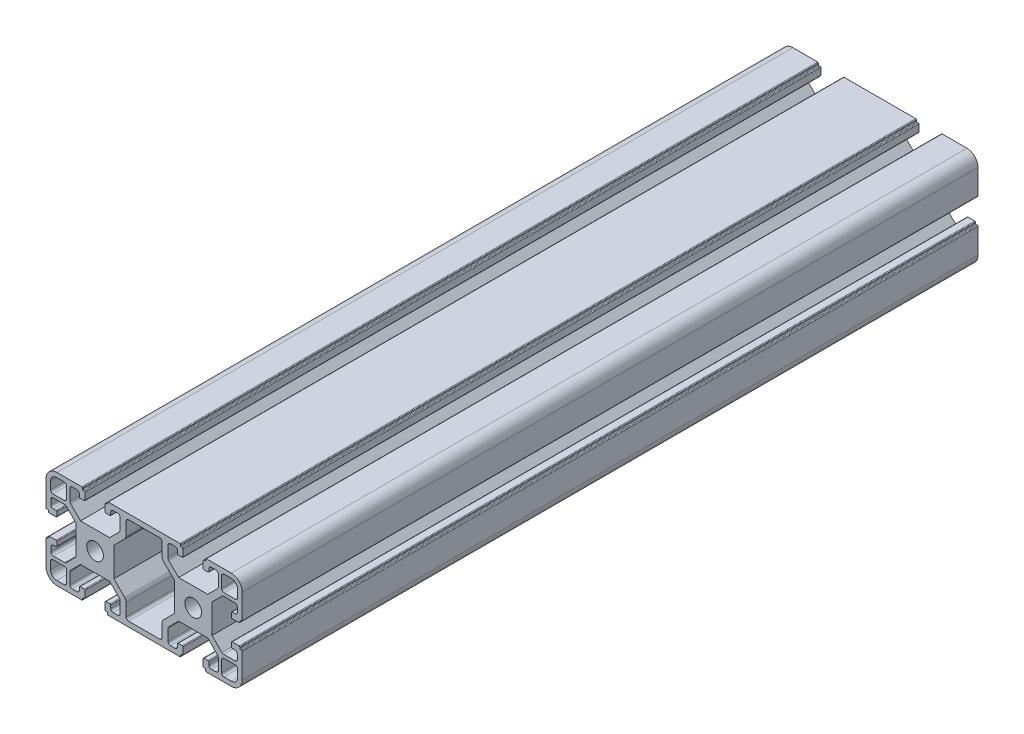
SolidWorks part; units mm, degrees
ref_plane "前视基准面" through (0, 0, 0) normal (0, 0, 1) x (1, 0, 0)
ref_plane "上视基准面" through (0, 0, 0) normal (0, 1, 0) x (1, 0, 0)
ref_plane "右视基准面" through (0, 0, 0) normal (1, 0, 0) x (0, 0, -1)
sketch "Model" plane through (0, 0, 0) normal (0, 0, 1) x (1, 0, 0)
  line L0 (2332.8218, 1245.2954) -> (2328.7969, 1241.2705)
  line L1 (2328.7969, 1241.2705) -> (2328.7969, 1229.406)
  line L2 (2328.7969, 1229.406) -> (2332.8218, 1225.3812)
  line L3 (2333.5289, 1225.0883) -> (2338.0969, 1225.0883)
  line L4 (2339.0969, 1226.0883) -> (2339.0969, 1227.9383)
  line L5 (2338.0969, 1228.9383) -> (2336.9969, 1228.9383)
  line L6 (2336.6969, 1229.2383) -> (2336.6969, 1230.9383)
  line L7 (2336.9969, 1231.2383) -> (2339.7969, 1231.2383)
  line L8 (2340.0969, 1230.9383) -> (2340.0969, 1230.5383)
  line L9 (2340.3969, 1230.2383) -> (2340.7969, 1230.2383)
  line L10 (2341.0969, 1229.9383) -> (2341.0969, 1219.8383)
  line L11 (2336.5969, 1215.3383) -> (2326.4969, 1215.3383)
  line L12 (2326.1969, 1215.6383) -> (2326.1969, 1216.0383)
  line L13 (2325.8969, 1216.3383) -> (2325.4969, 1216.3383)
  line L14 (2325.1969, 1216.6383) -> (2325.1969, 1219.4383)
  line L15 (2325.4969, 1219.7383) -> (2327.1969, 1219.7383)
  line L16 (2327.4969, 1219.4383) -> (2327.4969, 1218.3383)
  line L17 (2328.4969, 1217.3383) -> (2330.3469, 1217.3383)
  line L18 (2331.3469, 1218.3383) -> (2331.3469, 1222.9063)
  line L19 (2331.054, 1223.6134) -> (2327.0292, 1227.6383)
  line L20 (2327.0292, 1227.6383) -> (2315.1647, 1227.6383)
  line L21 (2315.1647, 1227.6383) -> (2311.1398, 1223.6134)
  line L22 (2310.8469, 1222.9063) -> (2310.8469, 1218.3383)
  line L23 (2311.8469, 1217.3383) -> (2313.6969, 1217.3383)
  line L24 (2314.6969, 1218.3383) -> (2314.6969, 1219.4383)
  line L25 (2314.9969, 1219.7383) -> (2316.6969, 1219.7383)
  line L26 (2316.9969, 1219.4383) -> (2316.9969, 1216.6383)
  line L27 (2316.6969, 1216.3383) -> (2316.2969, 1216.3383)
  line L28 (2315.9969, 1216.0383) -> (2315.9969, 1215.6383)
  line L29 (2315.6969, 1215.3383) -> (2286.4969, 1215.3383)
  line L30 (2286.1969, 1215.6383) -> (2286.1969, 1216.0383)
  line L31 (2285.8969, 1216.3383) -> (2285.4969, 1216.3383)
  line L32 (2285.1969, 1216.6383) -> (2285.1969, 1219.4383)
  line L33 (2285.4969, 1219.7383) -> (2287.1969, 1219.7383)
  line L34 (2287.4969, 1219.4383) -> (2287.4969, 1218.3383)
  line L35 (2288.4969, 1217.3383) -> (2290.3469, 1217.3383)
  line L36 (2291.3469, 1218.3383) -> (2291.3469, 1222.9063)
  line L37 (2291.054, 1223.6134) -> (2287.0292, 1227.6383)
  line L38 (2287.0292, 1227.6383) -> (2275.1647, 1227.6383)
  line L39 (2275.1647, 1227.6383) -> (2271.1398, 1223.6134)
  line L40 (2270.8469, 1222.9063) -> (2270.8469, 1218.3383)
  line L41 (2271.8469, 1217.3383) -> (2273.6969, 1217.3383)
  line L42 (2274.6969, 1218.3383) -> (2274.6969, 1219.4383)
  line L43 (2274.9969, 1219.7383) -> (2276.6969, 1219.7383)
  line L44 (2276.9969, 1219.4383) -> (2276.9969, 1216.6383)
  line L45 (2276.6969, 1216.3383) -> (2276.2969, 1216.3383)
  line L46 (2275.9969, 1216.0383) -> (2275.9969, 1215.6383)
  line L47 (2275.6969, 1215.3383) -> (2265.5969, 1215.3383)
  line L48 (2261.0969, 1219.8383) -> (2261.0969, 1229.9383)
  line L49 (2261.3969, 1230.2383) -> (2261.7969, 1230.2383)
  line L50 (2262.0969, 1230.5383) -> (2262.0969, 1230.9383)
  line L51 (2262.3969, 1231.2383) -> (2265.1969, 1231.2383)
  line L52 (2265.4969, 1230.9383) -> (2265.4969, 1229.2383)
  line L53 (2265.1969, 1228.9383) -> (2264.0969, 1228.9383)
  line L54 (2263.0969, 1227.9383) -> (2263.0969, 1226.0883)
  line L55 (2264.0969, 1225.0883) -> (2268.665, 1225.0883)
  line L56 (2269.3721, 1225.3812) -> (2273.3969, 1229.406)
  line L57 (2273.3969, 1229.406) -> (2273.3969, 1241.2705)
  line L58 (2273.3969, 1241.2705) -> (2269.3721, 1245.2954)
  line L59 (2268.665, 1245.5883) -> (2264.0969, 1245.5883)
  line L60 (2263.0969, 1244.5883) -> (2263.0969, 1242.7383)
  line L61 (2264.0969, 1241.7383) -> (2265.1969, 1241.7383)
  line L62 (2265.4969, 1241.4383) -> (2265.4969, 1239.7383)
  line L63 (2265.1969, 1239.4383) -> (2262.3969, 1239.4383)
  line L64 (2262.0969, 1239.7383) -> (2262.0969, 1240.1383)
  line L65 (2261.7969, 1240.4383) -> (2261.3969, 1240.4383)
  line L66 (2261.0969, 1240.7383) -> (2261.0969, 1250.8383)
  line L67 (2265.5969, 1255.3383) -> (2275.6969, 1255.3383)
  line L68 (2275.9969, 1255.0383) -> (2275.9969, 1254.6383)
  line L69 (2276.2969, 1254.3383) -> (2276.6969, 1254.3383)
  line L70 (2276.9969, 1254.0383) -> (2276.9969, 1251.2383)
  line L71 (2276.6969, 1250.9383) -> (2274.9969, 1250.9383)
  line L72 (2274.6969, 1251.2383) -> (2274.6969, 1252.3383)
  line L73 (2273.6969, 1253.3383) -> (2271.8469, 1253.3383)
  line L74 (2270.8469, 1252.3383) -> (2270.8469, 1247.7702)
  line L75 (2271.1398, 1247.0631) -> (2275.1647, 1243.0383)
  line L76 (2275.1647, 1243.0383) -> (2287.0292, 1243.0383)
  line L77 (2287.0292, 1243.0383) -> (2291.054, 1247.0631)
  line L78 (2291.3469, 1247.7702) -> (2291.3469, 1252.3383)
  line L79 (2290.3469, 1253.3383) -> (2288.4969, 1253.3383)
  line L80 (2287.4969, 1252.3383) -> (2287.4969, 1251.2383)
  line L81 (2287.1969, 1250.9383) -> (2285.4969, 1250.9383)
  line L82 (2285.1969, 1251.2383) -> (2285.1969, 1254.0383)
  line L83 (2285.4969, 1254.3383) -> (2285.8969, 1254.3383)
  line L84 (2286.1969, 1254.6383) -> (2286.1969, 1255.0383)
  line L85 (2286.4969, 1255.3383) -> (2315.6969, 1255.3383)
  line L86 (2315.9969, 1255.0383) -> (2315.9969, 1254.6383)
  line L87 (2316.2969, 1254.3383) -> (2316.6969, 1254.3383)
  line L88 (2316.9969, 1254.0383) -> (2316.9969, 1251.2383)
  line L89 (2316.6969, 1250.9383) -> (2314.9969, 1250.9383)
  line L90 (2314.6969, 1251.2383) -> (2314.6969, 1252.3383)
  line L91 (2313.6969, 1253.3383) -> (2311.8469, 1253.3383)
  line L92 (2310.8469, 1252.3383) -> (2310.8469, 1247.7702)
  line L93 (2311.1398, 1247.0631) -> (2315.1647, 1243.0383)
  line L94 (2315.1647, 1243.0383) -> (2327.0292, 1243.0383)
  line L95 (2327.0292, 1243.0383) -> (2331.054, 1247.0631)
  line L96 (2331.3469, 1247.7702) -> (2331.3469, 1252.3383)
  line L97 (2330.3469, 1253.3383) -> (2328.4969, 1253.3383)
  line L98 (2327.4969, 1252.3383) -> (2327.4969, 1251.2383)
  line L99 (2327.1969, 1250.9383) -> (2325.4969, 1250.9383)
  line L100 (2325.1969, 1251.2383) -> (2325.1969, 1254.0383)
  line L101 (2325.4969, 1254.3383) -> (2325.8969, 1254.3383)
  line L102 (2326.1969, 1254.6383) -> (2326.1969, 1255.0383)
  line L103 (2326.4969, 1255.3383) -> (2336.5969, 1255.3383)
  line L104 (2341.0969, 1250.8383) -> (2341.0969, 1240.7383)
  line L105 (2340.7969, 1240.4383) -> (2340.3969, 1240.4383)
  line L106 (2340.0969, 1240.1383) -> (2340.0969, 1239.7383)
  line L107 (2339.7969, 1239.4383) -> (2336.9969, 1239.4383)
  line L108 (2336.6969, 1239.7383) -> (2336.6969, 1241.4383)
  line L109 (2336.9969, 1241.7383) -> (2338.0969, 1241.7383)
  line L110 (2339.0969, 1242.7383) -> (2339.0969, 1244.5883)
  line L111 (2338.0969, 1245.5883) -> (2333.5289, 1245.5883)
  line L112 (2307.4469, 1217.4383) -> (2294.7469, 1217.4383)
  line L113 (2293.7469, 1218.4383) -> (2293.7469, 1223.6276)
  line L114 (2293.1611, 1225.0418) -> (2288.7969, 1229.406)
  line L115 (2288.7969, 1229.406) -> (2288.7969, 1241.2705)
  line L116 (2288.7969, 1241.2705) -> (2293.1611, 1245.6347)
  line L117 (2293.7469, 1247.0489) -> (2293.7469, 1252.2383)
  line L118 (2294.7469, 1253.2383) -> (2307.4469, 1253.2383)
  line L119 (2308.4469, 1252.2383) -> (2308.4469, 1247.0489)
  line L120 (2309.0327, 1245.6347) -> (2313.3969, 1241.2705)
  line L121 (2313.3969, 1241.2705) -> (2313.3969, 1229.406)
  line L122 (2313.3969, 1229.406) -> (2309.0327, 1225.0418)
  line L123 (2308.4469, 1223.6276) -> (2308.4469, 1218.4383)
  line L124 (2268.4969, 1253.4883) -> (2265.4469, 1253.4883)
  line L125 (2262.9469, 1250.9883) -> (2262.9469, 1247.9383)
  line L126 (2263.9469, 1246.9383) -> (2268.4969, 1246.9383)
  line L127 (2269.4969, 1247.9383) -> (2269.4969, 1252.4883)
  line L128 (2265.4469, 1217.1883) -> (2268.4969, 1217.1883)
  line L129 (2269.4969, 1218.1883) -> (2269.4969, 1222.7383)
  line L130 (2268.4969, 1223.7383) -> (2263.9469, 1223.7383)
  line L131 (2262.9469, 1222.7383) -> (2262.9469, 1219.6883)
  line L132 (2333.6969, 1253.4883) -> (2336.7469, 1253.4883)
  line L133 (2339.2469, 1250.9883) -> (2339.2469, 1247.9383)
  line L134 (2338.2469, 1246.9383) -> (2333.6969, 1246.9383)
  line L135 (2332.6969, 1247.9383) -> (2332.6969, 1252.4883)
  line L136 (2336.7469, 1217.1883) -> (2333.6969, 1217.1883)
  line L137 (2332.6969, 1218.1883) -> (2332.6969, 1222.7383)
  line L138 (2333.6969, 1223.7383) -> (2338.2469, 1223.7383)
  line L139 (2339.2469, 1222.7383) -> (2339.2469, 1219.6883)
  circle A0 centre (2321.0969, 1235.3383) radius 3.4
  circle A1 centre (2281.0969, 1235.3383) radius 3.4
  arc A2 (2332.8218, 1225.3812) -> (2333.5289, 1225.0883) centre (2333.5289, 1226.0883) ccw
  arc A3 (2338.0969, 1225.0883) -> (2339.0969, 1226.0883) centre (2338.0969, 1226.0883) ccw
  arc A4 (2339.0969, 1227.9383) -> (2338.0969, 1228.9383) centre (2338.0969, 1227.9383) ccw
  arc A5 (2336.6969, 1229.2383) -> (2336.9969, 1228.9383) centre (2336.9969, 1229.2383) ccw
  arc A6 (2336.9969, 1231.2383) -> (2336.6969, 1230.9383) centre (2336.9969, 1230.9383) ccw
  arc A7 (2340.0969, 1230.9383) -> (2339.7969, 1231.2383) centre (2339.7969, 1230.9383) ccw
  arc A8 (2340.0969, 1230.5383) -> (2340.3969, 1230.2383) centre (2340.3969, 1230.5383) ccw
  arc A9 (2341.0969, 1229.9383) -> (2340.7969, 1230.2383) centre (2340.7969, 1229.9383) ccw
  arc A10 (2336.5969, 1215.3383) -> (2341.0969, 1219.8383) centre (2336.5969, 1219.8383) ccw
  arc A11 (2326.1969, 1215.6383) -> (2326.4969, 1215.3383) centre (2326.4969, 1215.6383) ccw
  arc A12 (2326.1969, 1216.0383) -> (2325.8969, 1216.3383) centre (2325.8969, 1216.0383) ccw
  arc A13 (2325.1969, 1216.6383) -> (2325.4969, 1216.3383) centre (2325.4969, 1216.6383) ccw
  arc A14 (2325.4969, 1219.7383) -> (2325.1969, 1219.4383) centre (2325.4969, 1219.4383) ccw
  arc A15 (2327.4969, 1219.4383) -> (2327.1969, 1219.7383) centre (2327.1969, 1219.4383) ccw
  arc A16 (2327.4969, 1218.3383) -> (2328.4969, 1217.3383) centre (2328.4969, 1218.3383) ccw
  arc A17 (2330.3469, 1217.3383) -> (2331.3469, 1218.3383) centre (2330.3469, 1218.3383) ccw
  arc A18 (2331.3469, 1222.9063) -> (2331.054, 1223.6134) centre (2330.3469, 1222.9063) ccw
  arc A19 (2311.1398, 1223.6134) -> (2310.8469, 1222.9063) centre (2311.8469, 1222.9063) ccw
  arc A20 (2310.8469, 1218.3383) -> (2311.8469, 1217.3383) centre (2311.8469, 1218.3383) ccw
  arc A21 (2313.6969, 1217.3383) -> (2314.6969, 1218.3383) centre (2313.6969, 1218.3383) ccw
  arc A22 (2314.9969, 1219.7383) -> (2314.6969, 1219.4383) centre (2314.9969, 1219.4383) ccw
  arc A23 (2316.9969, 1219.4383) -> (2316.6969, 1219.7383) centre (2316.6969, 1219.4383) ccw
  arc A24 (2316.6969, 1216.3383) -> (2316.9969, 1216.6383) centre (2316.6969, 1216.6383) ccw
  arc A25 (2316.2969, 1216.3383) -> (2315.9969, 1216.0383) centre (2316.2969, 1216.0383) ccw
  arc A26 (2315.6969, 1215.3383) -> (2315.9969, 1215.6383) centre (2315.6969, 1215.6383) ccw
  arc A27 (2286.1969, 1215.6383) -> (2286.4969, 1215.3383) centre (2286.4969, 1215.6383) ccw
  arc A28 (2286.1969, 1216.0383) -> (2285.8969, 1216.3383) centre (2285.8969, 1216.0383) ccw
  arc A29 (2285.1969, 1216.6383) -> (2285.4969, 1216.3383) centre (2285.4969, 1216.6383) ccw
  arc A30 (2285.4969, 1219.7383) -> (2285.1969, 1219.4383) centre (2285.4969, 1219.4383) ccw
  arc A31 (2287.4969, 1219.4383) -> (2287.1969, 1219.7383) centre (2287.1969, 1219.4383) ccw
  arc A32 (2287.4969, 1218.3383) -> (2288.4969, 1217.3383) centre (2288.4969, 1218.3383) ccw
  arc A33 (2290.3469, 1217.3383) -> (2291.3469, 1218.3383) centre (2290.3469, 1218.3383) ccw
  arc A34 (2291.3469, 1222.9063) -> (2291.054, 1223.6134) centre (2290.3469, 1222.9063) ccw
  arc A35 (2271.1398, 1223.6134) -> (2270.8469, 1222.9063) centre (2271.8469, 1222.9063) ccw
  arc A36 (2270.8469, 1218.3383) -> (2271.8469, 1217.3383) centre (2271.8469, 1218.3383) ccw
  arc A37 (2273.6969, 1217.3383) -> (2274.6969, 1218.3383) centre (2273.6969, 1218.3383) ccw
  arc A38 (2274.9969, 1219.7383) -> (2274.6969, 1219.4383) centre (2274.9969, 1219.4383) ccw
  arc A39 (2276.9969, 1219.4383) -> (2276.6969, 1219.7383) centre (2276.6969, 1219.4383) ccw
  arc A40 (2276.6969, 1216.3383) -> (2276.9969, 1216.6383) centre (2276.6969, 1216.6383) ccw
  arc A41 (2276.2969, 1216.3383) -> (2275.9969, 1216.0383) centre (2276.2969, 1216.0383) ccw
  arc A42 (2275.6969, 1215.3383) -> (2275.9969, 1215.6383) centre (2275.6969, 1215.6383) ccw
  arc A43 (2261.0969, 1219.8383) -> (2265.5969, 1215.3383) centre (2265.5969, 1219.8383) ccw
  arc A44 (2261.3969, 1230.2383) -> (2261.0969, 1229.9383) centre (2261.3969, 1229.9383) ccw
  arc A45 (2261.7969, 1230.2383) -> (2262.0969, 1230.5383) centre (2261.7969, 1230.5383) ccw
  arc A46 (2262.3969, 1231.2383) -> (2262.0969, 1230.9383) centre (2262.3969, 1230.9383) ccw
  arc A47 (2265.4969, 1230.9383) -> (2265.1969, 1231.2383) centre (2265.1969, 1230.9383) ccw
  arc A48 (2265.1969, 1228.9383) -> (2265.4969, 1229.2383) centre (2265.1969, 1229.2383) ccw
  arc A49 (2264.0969, 1228.9383) -> (2263.0969, 1227.9383) centre (2264.0969, 1227.9383) ccw
  arc A50 (2263.0969, 1226.0883) -> (2264.0969, 1225.0883) centre (2264.0969, 1226.0883) ccw
  arc A51 (2268.665, 1225.0883) -> (2269.3721, 1225.3812) centre (2268.665, 1226.0883) ccw
  arc A52 (2269.3721, 1245.2954) -> (2268.665, 1245.5883) centre (2268.665, 1244.5883) ccw
  arc A53 (2264.0969, 1245.5883) -> (2263.0969, 1244.5883) centre (2264.0969, 1244.5883) ccw
  arc A54 (2263.0969, 1242.7383) -> (2264.0969, 1241.7383) centre (2264.0969, 1242.7383) ccw
  arc A55 (2265.4969, 1241.4383) -> (2265.1969, 1241.7383) centre (2265.1969, 1241.4383) ccw
  arc A56 (2265.1969, 1239.4383) -> (2265.4969, 1239.7383) centre (2265.1969, 1239.7383) ccw
  arc A57 (2262.0969, 1239.7383) -> (2262.3969, 1239.4383) centre (2262.3969, 1239.7383) ccw
  arc A58 (2262.0969, 1240.1383) -> (2261.7969, 1240.4383) centre (2261.7969, 1240.1383) ccw
  arc A59 (2261.0969, 1240.7383) -> (2261.3969, 1240.4383) centre (2261.3969, 1240.7383) ccw
  arc A60 (2265.5969, 1255.3383) -> (2261.0969, 1250.8383) centre (2265.5969, 1250.8383) ccw
  arc A61 (2275.9969, 1255.0383) -> (2275.6969, 1255.3383) centre (2275.6969, 1255.0383) ccw
  arc A62 (2275.9969, 1254.6383) -> (2276.2969, 1254.3383) centre (2276.2969, 1254.6383) ccw
  arc A63 (2276.9969, 1254.0383) -> (2276.6969, 1254.3383) centre (2276.6969, 1254.0383) ccw
  arc A64 (2276.6969, 1250.9383) -> (2276.9969, 1251.2383) centre (2276.6969, 1251.2383) ccw
  arc A65 (2274.6969, 1251.2383) -> (2274.9969, 1250.9383) centre (2274.9969, 1251.2383) ccw
  arc A66 (2274.6969, 1252.3383) -> (2273.6969, 1253.3383) centre (2273.6969, 1252.3383) ccw
  arc A67 (2271.8469, 1253.3383) -> (2270.8469, 1252.3383) centre (2271.8469, 1252.3383) ccw
  arc A68 (2270.8469, 1247.7702) -> (2271.1398, 1247.0631) centre (2271.8469, 1247.7702) ccw
  arc A69 (2291.054, 1247.0631) -> (2291.3469, 1247.7702) centre (2290.3469, 1247.7702) ccw
  arc A70 (2291.3469, 1252.3383) -> (2290.3469, 1253.3383) centre (2290.3469, 1252.3383) ccw
  arc A71 (2288.4969, 1253.3383) -> (2287.4969, 1252.3383) centre (2288.4969, 1252.3383) ccw
  arc A72 (2287.1969, 1250.9383) -> (2287.4969, 1251.2383) centre (2287.1969, 1251.2383) ccw
  arc A73 (2285.1969, 1251.2383) -> (2285.4969, 1250.9383) centre (2285.4969, 1251.2383) ccw
  arc A74 (2285.4969, 1254.3383) -> (2285.1969, 1254.0383) centre (2285.4969, 1254.0383) ccw
  arc A75 (2285.8969, 1254.3383) -> (2286.1969, 1254.6383) centre (2285.8969, 1254.6383) ccw
  arc A76 (2286.4969, 1255.3383) -> (2286.1969, 1255.0383) centre (2286.4969, 1255.0383) ccw
  arc A77 (2315.9969, 1255.0383) -> (2315.6969, 1255.3383) centre (2315.6969, 1255.0383) ccw
  arc A78 (2315.9969, 1254.6383) -> (2316.2969, 1254.3383) centre (2316.2969, 1254.6383) ccw
  arc A79 (2316.9969, 1254.0383) -> (2316.6969, 1254.3383) centre (2316.6969, 1254.0383) ccw
  arc A80 (2316.6969, 1250.9383) -> (2316.9969, 1251.2383) centre (2316.6969, 1251.2383) ccw
  arc A81 (2314.6969, 1251.2383) -> (2314.9969, 1250.9383) centre (2314.9969, 1251.2383) ccw
  arc A82 (2314.6969, 1252.3383) -> (2313.6969, 1253.3383) centre (2313.6969, 1252.3383) ccw
  arc A83 (2311.8469, 1253.3383) -> (2310.8469, 1252.3383) centre (2311.8469, 1252.3383) ccw
  arc A84 (2310.8469, 1247.7702) -> (2311.1398, 1247.0631) centre (2311.8469, 1247.7702) ccw
  arc A85 (2331.054, 1247.0631) -> (2331.3469, 1247.7702) centre (2330.3469, 1247.7702) ccw
  arc A86 (2331.3469, 1252.3383) -> (2330.3469, 1253.3383) centre (2330.3469, 1252.3383) ccw
  arc A87 (2328.4969, 1253.3383) -> (2327.4969, 1252.3383) centre (2328.4969, 1252.3383) ccw
  arc A88 (2327.1969, 1250.9383) -> (2327.4969, 1251.2383) centre (2327.1969, 1251.2383) ccw
  arc A89 (2325.1969, 1251.2383) -> (2325.4969, 1250.9383) centre (2325.4969, 1251.2383) ccw
  arc A90 (2325.4969, 1254.3383) -> (2325.1969, 1254.0383) centre (2325.4969, 1254.0383) ccw
  arc A91 (2325.8969, 1254.3383) -> (2326.1969, 1254.6383) centre (2325.8969, 1254.6383) ccw
  arc A92 (2326.4969, 1255.3383) -> (2326.1969, 1255.0383) centre (2326.4969, 1255.0383) ccw
  arc A93 (2341.0969, 1250.8383) -> (2336.5969, 1255.3383) centre (2336.5969, 1250.8383) ccw
  arc A94 (2340.7969, 1240.4383) -> (2341.0969, 1240.7383) centre (2340.7969, 1240.7383) ccw
  arc A95 (2340.3969, 1240.4383) -> (2340.0969, 1240.1383) centre (2340.3969, 1240.1383) ccw
  arc A96 (2339.7969, 1239.4383) -> (2340.0969, 1239.7383) centre (2339.7969, 1239.7383) ccw
  arc A97 (2336.6969, 1239.7383) -> (2336.9969, 1239.4383) centre (2336.9969, 1239.7383) ccw
  arc A98 (2336.9969, 1241.7383) -> (2336.6969, 1241.4383) centre (2336.9969, 1241.4383) ccw
  arc A99 (2338.0969, 1241.7383) -> (2339.0969, 1242.7383) centre (2338.0969, 1242.7383) ccw
  arc A100 (2339.0969, 1244.5883) -> (2338.0969, 1245.5883) centre (2338.0969, 1244.5883) ccw
  arc A101 (2333.5289, 1245.5883) -> (2332.8218, 1245.2954) centre (2333.5289, 1244.5883) ccw
  arc A102 (2293.7469, 1218.4383) -> (2294.7469, 1217.4383) centre (2294.7469, 1218.4383) ccw
  arc A103 (2293.7469, 1223.6276) -> (2293.1611, 1225.0418) centre (2291.7469, 1223.6276) ccw
  arc A104 (2293.1611, 1245.6347) -> (2293.7469, 1247.0489) centre (2291.7469, 1247.0489) ccw
  arc A105 (2294.7469, 1253.2383) -> (2293.7469, 1252.2383) centre (2294.7469, 1252.2383) ccw
  arc A106 (2308.4469, 1252.2383) -> (2307.4469, 1253.2383) centre (2307.4469, 1252.2383) ccw
  arc A107 (2308.4469, 1247.0489) -> (2309.0327, 1245.6347) centre (2310.4469, 1247.0489) ccw
  arc A108 (2309.0327, 1225.0418) -> (2308.4469, 1223.6276) centre (2310.4469, 1223.6276) ccw
  arc A109 (2307.4469, 1217.4383) -> (2308.4469, 1218.4383) centre (2307.4469, 1218.4383) ccw
  arc A110 (2265.4469, 1253.4883) -> (2262.9469, 1250.9883) centre (2265.4469, 1250.9883) ccw
  arc A111 (2262.9469, 1247.9383) -> (2263.9469, 1246.9383) centre (2263.9469, 1247.9383) ccw
  arc A112 (2268.4969, 1246.9383) -> (2269.4969, 1247.9383) centre (2268.4969, 1247.9383) ccw
  arc A113 (2269.4969, 1252.4883) -> (2268.4969, 1253.4883) centre (2268.4969, 1252.4883) ccw
  arc A114 (2268.4969, 1217.1883) -> (2269.4969, 1218.1883) centre (2268.4969, 1218.1883) ccw
  arc A115 (2269.4969, 1222.7383) -> (2268.4969, 1223.7383) centre (2268.4969, 1222.7383) ccw
  arc A116 (2263.9469, 1223.7383) -> (2262.9469, 1222.7383) centre (2263.9469, 1222.7383) ccw
  arc A117 (2262.9469, 1219.6883) -> (2265.4469, 1217.1883) centre (2265.4469, 1219.6883) ccw
  arc A118 (2339.2469, 1250.9883) -> (2336.7469, 1253.4883) centre (2336.7469, 1250.9883) ccw
  arc A119 (2338.2469, 1246.9383) -> (2339.2469, 1247.9383) centre (2338.2469, 1247.9383) ccw
  arc A120 (2332.6969, 1247.9383) -> (2333.6969, 1246.9383) centre (2333.6969, 1247.9383) ccw
  arc A121 (2333.6969, 1253.4883) -> (2332.6969, 1252.4883) centre (2333.6969, 1252.4883) ccw
  arc A122 (2332.6969, 1218.1883) -> (2333.6969, 1217.1883) centre (2333.6969, 1218.1883) ccw
  arc A123 (2333.6969, 1223.7383) -> (2332.6969, 1222.7383) centre (2333.6969, 1222.7383) ccw
  arc A124 (2339.2469, 1222.7383) -> (2338.2469, 1223.7383) centre (2338.2469, 1222.7383) ccw
  arc A125 (2336.7469, 1217.1883) -> (2339.2469, 1219.6883) centre (2336.7469, 1219.6883) ccw
extrude "凸台-拉伸1" add sketch "Model" along normal blind 300
